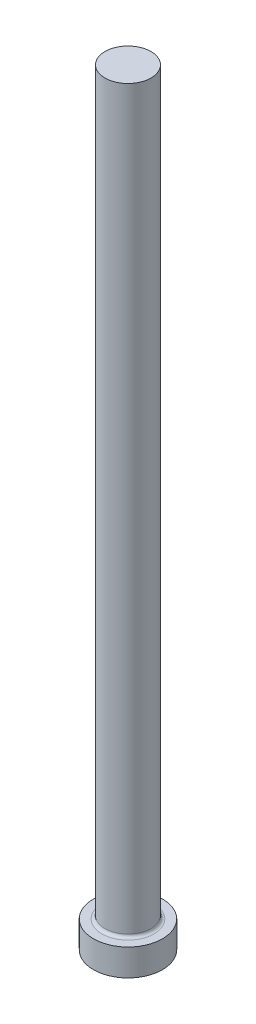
SolidWorks part; units mm, degrees
ref_plane "Plano frontal" through (0, 0, 0) normal (0, 0, 1) x (1, 0, 0)
ref_plane "Plano superior" through (0, 0, 0) normal (0, 1, 0) x (1, 0, 0)
ref_plane "Plano direito" through (0, 0, 0) normal (1, 0, 0) x (0, 0, -1)
sketch "Esboço1" plane through (0, 0, 0) normal (0, 0, 1) x (1, 0, 0)
  line L0 (0, 0) -> (9, 0)
  line L1 (9, 0) -> (9, 7)
  line L2 (9, 7) -> (6.8, 7)
  line L3 (6, 7.8) -> (6, 200)
  line L4 (6, 200) -> (0, 200)
  line L5 (0, 200) -> (0, 0) construction
  line L6 (0, 0) -> (0, 200)
  arc A0 (6.8, 7) -> (6, 7.8) centre (6.8, 7.8) cw
  dimension "D3" = 0.8
  dimension "D1" = 18
  dimension "D2" = 12
  dimension "D4" = 7
  dimension "D5" = 200
revolve "Revolução1" add sketch "Esboço1" angle 360 about L5
sketch "Esboço2"
  dimension "D1" = 1.0125
  dimension "D2" = 1.575
  dimension "D3" = 0.675
  dimension "D4" = 4.8375
wrap "Envolver1" sketch "Esboço2" wrap type deboss source sketch "Esboço2" thickness 0.1 parameters "D1"=0.1
